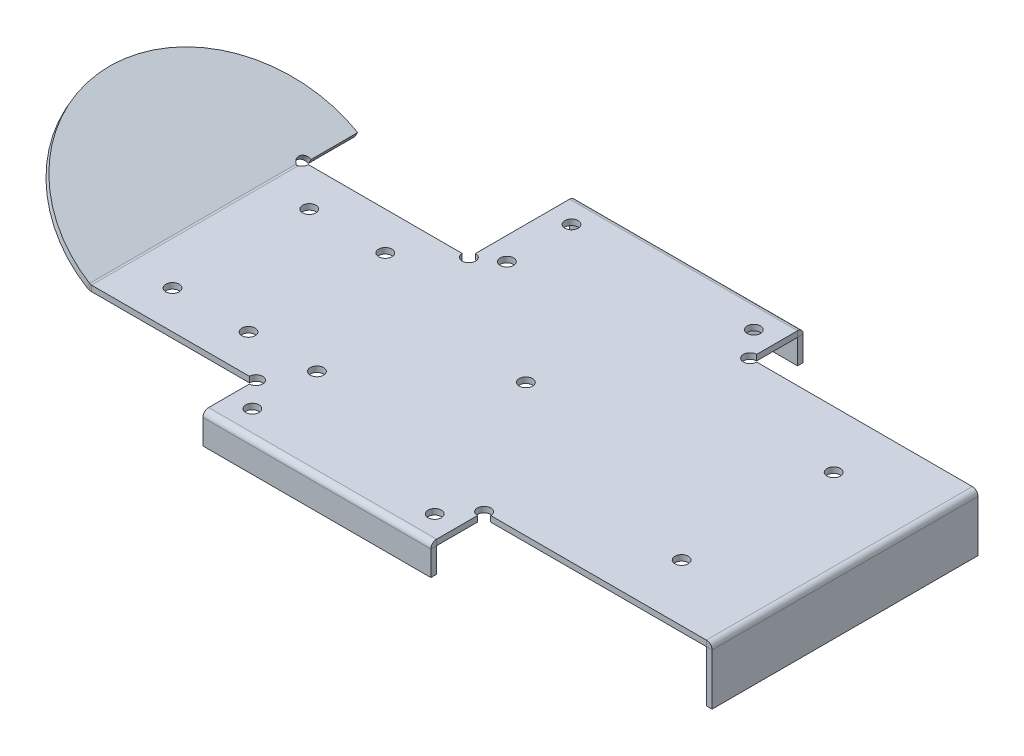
SolidWorks part; units mm, degrees
ref_plane "Front" through (0, 0, 0) normal (0, 0, 1) x (1, 0, 0)
ref_plane "Top" through (0, 0, 0) normal (0, 1, 0) x (1, 0, 0)
ref_plane "Right" through (0, 0, 0) normal (1, 0, 0) x (0, 0, -1)
sketch "Sketch1" plane through (0, 0, 0) normal (0, 1, 0) x (1, 0, 0)
  line L1 (44, 0) -> (104, 0)
  line L2 (0, 79.75) -> (0, 92)
  line L3 (44, 114) -> (104, 114)
  line L4 (1.75, 78) -> (42.25, 78)
  line L6 (105.75, 92) -> (179, 92)
  line L7 (0, 22) -> (42.25, 22)
  line L8 (44, 0) -> (44, 20.25)
  line L9 (0, 92) -> (179, 92) construction
  line L10 (104, 0) -> (104, 20.25)
  line L11 (0, 0) -> (0, 114) construction
  line L14 (179, 22) -> (179, 92)
  line L17 (105.75, 22) -> (179, 22)
  line L18 (0, 78) -> (179, 78) construction
  line L20 (104, 93.75) -> (104, 114)
  line L21 (104, 0) -> (104, 114) construction
  line L22 (44, 79.75) -> (44, 114)
  line L23 (44, 0) -> (44, 114) construction
  arc A0 (0, 92) -> (0, 22) centre (0, 57) ccw
  circle A1 centre (12, 68) radius 1.75
  circle A2 centre (32, 68) radius 1.75
  circle A3 centre (12, 32) radius 1.75
  circle A4 centre (32, 32) radius 1.75
  circle A5 centre (50, 82) radius 1.75
  circle A6 centre (50, 99) radius 1.75
  circle A7 centre (98, 99) radius 1.75
  circle A8 centre (98, 15) radius 1.75
  circle A9 centre (50, 15) radius 1.75
  circle A10 centre (50, 32) radius 1.75
  circle A11 centre (80, 57) radius 1.75
  circle A12 centre (141, 77) radius 1.75
  circle A13 centre (141, 37) radius 1.75
  arc A14 (104, 93.75) -> (105.75, 92) centre (104, 92) ccw
  arc A15 (42.25, 78) -> (44, 79.75) centre (44, 78) ccw
  arc A16 (0, 79.75) -> (1.75, 78) centre (0, 78) ccw
  arc A17 (44, 20.25) -> (42.25, 22) centre (44, 22) ccw
  arc A18 (105.75, 22) -> (104, 20.25) centre (104, 22) ccw
sheet metal parameters "Sheet-Metal1" thickness 1.5 parameters "D1"=0
base flange "Base-Flange1" sketch "Sketch1" thickness 1.5 reverse thickness direction yes parameters "D1"=0
sketch "Sketch3" plane through (0, 1.5, 0) normal (0, 1, 0) x (-1, 0, 0)
  line L3 (-44, -106) -> (-104, -106)
  line L4 (-104, -8) -> (-44, -8)
  line L5 (-164, -92) -> (-164, -22)
sketched bend "Sketched Bend2" parameters "D1"=0
bend "SketchBend4" bend radius 0 bend angle 90 parameters "D5"=1
bend "SketchBend5" bend radius 0 bend angle 90 parameters "D5"=2
bend "SketchBend6" bend radius 0 bend angle 90 parameters "D5"=3
sketch "Sketch4" plane through (0, 1.5, 0) normal (0, 1, 0) x (-1, 0, 0)
  line L0 (0, -76.25) -> (0, -22)
  arc A0 (0, -79.75) -> (-1.75, -78) centre (0, -78) ccw construction
sketched bend "Sketched Bend8" parameters "D1"=1
bend "SketchBend11" bend radius 1 bend angle 30 parameters "D5"=4
flat pattern "Flat-Pattern1"
sketch "Bend-Lines1" plane through (0, 1.5, 0) normal (0, 1, 0) x (-1, 0, 0)
  line L0 (0, -22) -> (0, -76.25) construction
  line L1 (-164, -22) -> (-164, -92) construction
  line L2 (-44, -8) -> (-104, -8) construction
  line L3 (-104, -106) -> (-44, -106) construction
bend of the flat pattern "Flatten-<SketchBend4>1"
bend of the flat pattern "Flatten-<SketchBend5>1"
bend of the flat pattern "Flatten-<SketchBend6>1"
bend of the flat pattern "Flatten-<SketchBend11>1"
